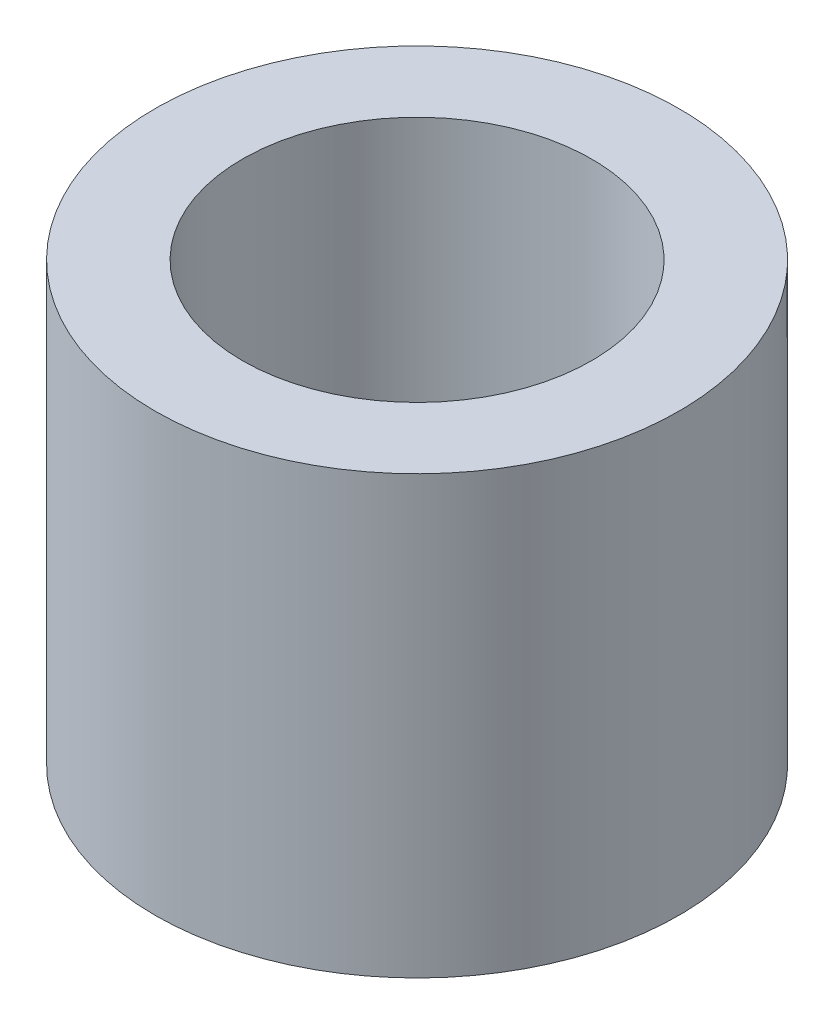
SolidWorks part; units mm, degrees
ref_plane "Спереди" through (0, 0, 0) normal (0, 0, 1) x (1, 0, 0)
ref_plane "Сверху" through (0, 0, 0) normal (0, 1, 0) x (1, 0, 0)
ref_plane "Справа" through (0, 0, 0) normal (1, 0, 0) x (0, 0, -1)
sketch "Эскиз1" plane through (0, 0, 0) normal (0, 1, 0) x (1, 0, 0)
  circle A0 centre (0, 0) radius 1.5
  circle A1 centre (0, 0) radius 1
  dimension "D1" = 3
  dimension "D2" = 0.5
extrude "Бобышка-Вытянуть1" add sketch "Эскиз1" along normal blind 2.5
